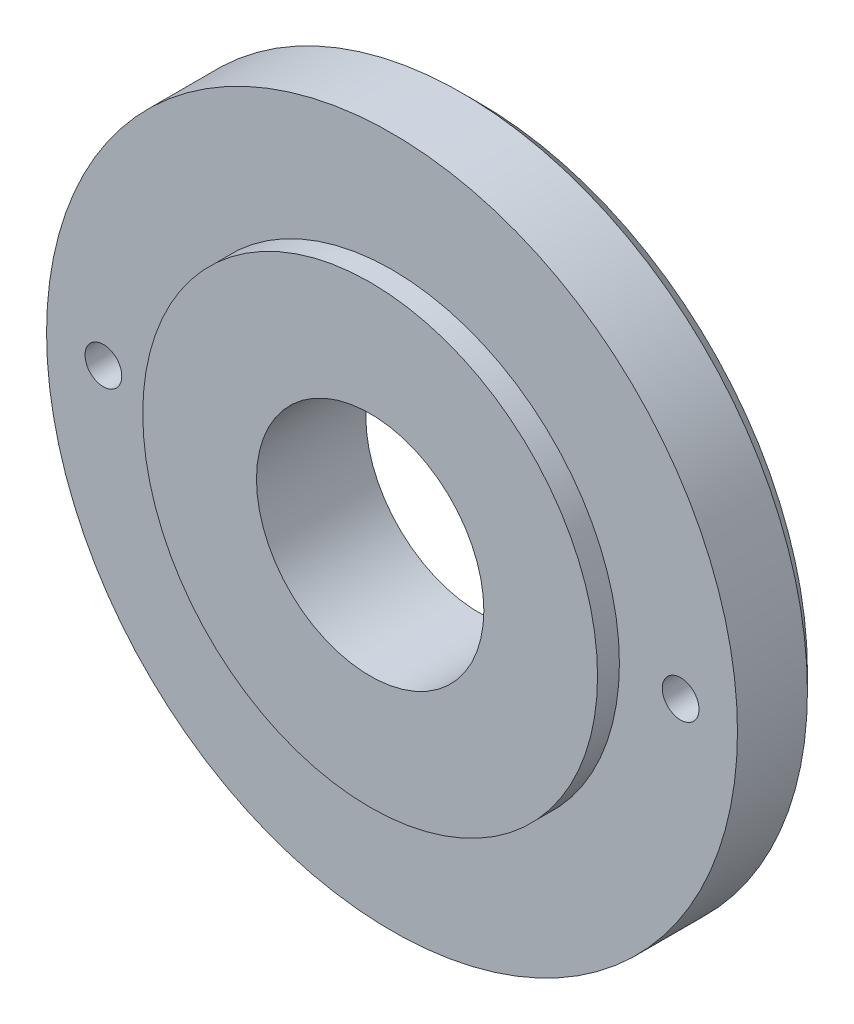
SolidWorks part; units mm, degrees
ref_plane "Face" through (0, 0, 0) normal (0, 0, 1) x (1, 0, 0)
ref_plane "Dessus" through (0, 0, 0) normal (0, 1, 0) x (1, 0, 0)
ref_plane "Droite" through (0, 0, 0) normal (1, 0, 0) x (0, 0, -1)
sketch "Esquisse1" plane through (0, 0, 0) normal (0, 0, 1) x (1, 0, 0)
  circle A0 centre (0, 0) radius 39.5
  circle A1 centre (0, 0) radius 13
  dimension "D1" = 26
  dimension "D2" = 79
extrude "Base-Extrusion" add sketch "Esquisse1" along normal blind 10
sketch "Esquisse2" plane through (0, 0, 10) normal (0, 0, 1) x (1, 0, 0)
  circle A0 centre (0, 0) radius 26
  circle A1 centre (0, 0) radius 13 construction
  circle A2 centre (0, 0) radius 13
  dimension "D1" = 52
extrude "Boss.-Extru.1" add sketch "Esquisse2" along normal blind 2.5
chamfer "Chanfrein1" distance 2 angle 45
sketch "Esquisse3" plane through (0, 0, 0) normal (0, 0, -1) x (-1, 0, 0)
  circle A0 centre (33, 0) radius 2.1
  circle A1 centre (-33, 0) radius 2.1
  dimension "D1" = 4.2
  dimension "D2" = 4.2
  dimension "D4" = 33
  dimension "D3" = 33
extrude "Enlèv. mat.-Extru.1" cut sketch "Esquisse3" against normal through all
